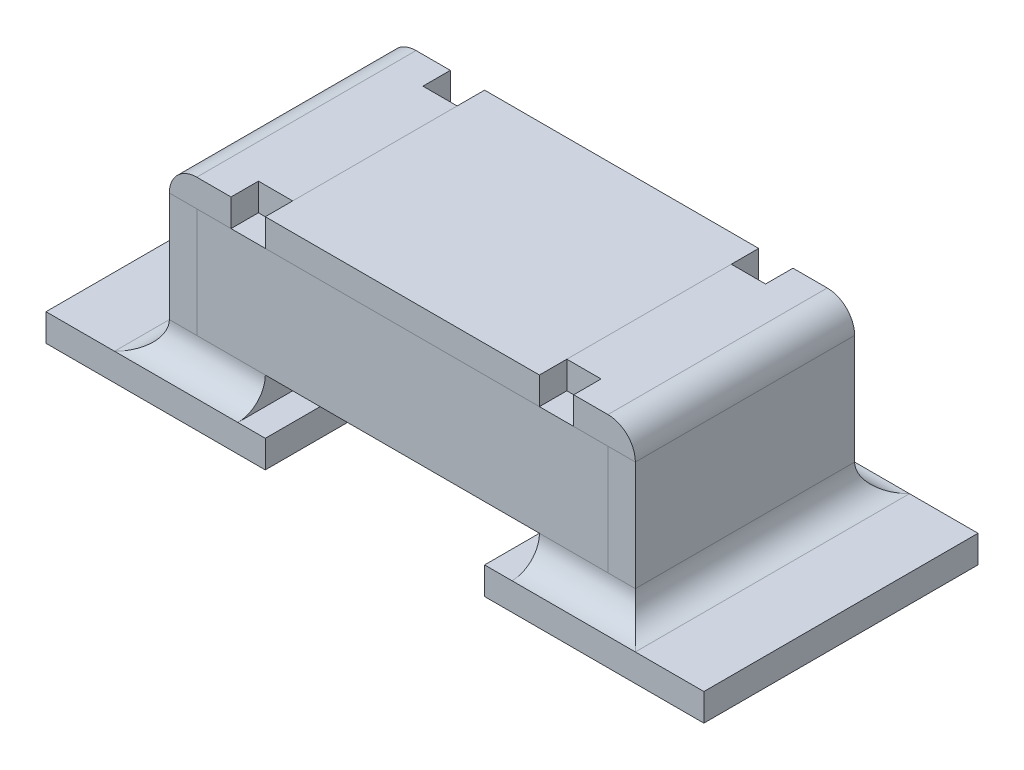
SolidWorks part; units mm, degrees
ref_plane "Plan de face" through (0, 0, 0) normal (0, 0, 1) x (1, 0, 0)
ref_plane "Plan de dessus" through (0, 0, 0) normal (0, 1, 0) x (1, 0, 0)
ref_plane "Plan de droite" through (0, 0, 0) normal (1, 0, 0) x (0, 0, -1)
sketch "Esquisse1" plane through (0, 0, 0) normal (0, 1, 0) x (1, 0, 0)
  line L0 (-0.4, 0) -> (0.4, 0) construction
  line L1 (-0.4, 0.5) -> (-1.2, 0.5)
  line L2 (-0.4, 0.5) -> (-0.4, -0.5)
  line L3 (-0.4, -0.5) -> (-1.2, -0.5)
  line L4 (-1.2, 0.5) -> (-1.2, -0.5)
  line L5 (0.4, 0.5) -> (1.2, 0.5)
  line L6 (0.4, 0.5) -> (0.4, -0.5)
  line L7 (0.4, -0.5) -> (1.2, -0.5)
  line L8 (1.2, 0.5) -> (1.2, -0.5)
  point P8 (-0.4, 0)
  point P12 (0, 0)
  dimension "D1" = 1
  dimension "D2" = 0.8
  dimension "D3" = 0.8
extrude "Boss.-Extru.1" add sketch "Esquisse1" along normal blind 0.1
sketch "Esquisse2" plane through (0, 0.1, 0) normal (0, 1, 0) x (1, 0, 0)
  line L0 (-0.4, 0.5) -> (-1.2, 0.5) construction
  line L1 (-0.85, 0.4) -> (-0.75, 0.4)
  line L2 (-0.85, 0.4) -> (-0.85, -0.4)
  line L3 (-0.85, -0.4) -> (-0.75, -0.4)
  line L4 (-0.75, 0.4) -> (-0.75, -0.4)
  line L5 (0.75, 0.4) -> (0.85, 0.4)
  line L6 (0.75, 0.4) -> (0.75, -0.4)
  line L7 (0.75, -0.4) -> (0.85, -0.4)
  line L8 (0.85, 0.4) -> (0.85, -0.4)
  line L9 (1.2, 0.5) -> (0.4, 0.5) construction
  line L10 (-1.2, -0.5) -> (-0.4, -0.5) construction
  point P8 (-0.8, 0.5)
  point P9 (0.8, 0.5)
  point P12 (-0.8, 0.4)
  point P15 (0.8, 0.4)
  dimension "D1" = 0.1
  dimension "D2" = 0.1
  dimension "D3" = 0.1
extrude "Boss.-Extru.2" add sketch "Esquisse2" along normal blind 0.5
sketch "Esquisse3" plane through (0, 0.1, 0) normal (0, 1, 0) x (1, 0, 0)
  line L0 (-0.85, -0.4) -> (-0.75, -0.4) construction
  line L1 (-0.75, 0.4) -> (-0.5, 0.4)
  line L2 (-0.75, 0.4) -> (-0.75, -0.4)
  line L3 (-0.75, -0.4) -> (-0.5, -0.4)
  line L4 (-0.5, 0.4) -> (-0.5, -0.4)
  line L5 (0.75, 0.4) -> (0.5, 0.4)
  line L6 (0.75, 0.4) -> (0.75, -0.4)
  line L7 (0.75, -0.4) -> (0.5, -0.4)
  line L8 (0.5, 0.4) -> (0.5, -0.4)
  line L9 (-0.4, -0.5) -> (-0.4, 0.5) construction
  line L10 (0.4, 0.5) -> (0.4, -0.5) construction
  dimension "D1" = 0.1
  dimension "D2" = 0.1
extrude "Boss.-Extru.3" add sketch "Esquisse3" along normal blind 0.1
fillet "Congé1" radius 0.1 3 edges at (-0.675, 0.1, -0.4) (-0.675, 0.1, 0.4) (-0.85, 0.1, 0)
fillet "Congé2" radius 0.1 3 edges at (0.675, 0.1, -0.4) (0.85, 0.1, 0) (0.675, 0.1, 0.4)
sketch "Esquisse4" plane through (0, 0.2, 0) normal (0, 1, 0) x (1, 0, 0)
  line L1 (-0.75, 0.4) -> (0.75, 0.4)
  line L2 (-0.75, 0.4) -> (-0.75, -0.4)
  line L3 (-0.75, -0.4) -> (0.75, -0.4)
  line L4 (0.75, 0.4) -> (0.75, -0.4)
extrude "Boss.-Extru.4" add sketch "Esquisse4" along normal blind 0.4 separate body
sketch "Esquisse5" plane through (0, 0.6, 0) normal (0, 1, 0) x (1, 0, 0)
  line L0 (0.75, 0.4) -> (-0.75, 0.4) construction
  line L1 (-0.5, 0.4) -> (0.5, 0.4)
  line L2 (-0.5, 0.4) -> (-0.5, -0.4)
  line L3 (-0.5, -0.4) -> (0.5, -0.4)
  line L4 (0.5, 0.4) -> (0.5, -0.4)
  line L5 (-0.75, -0.4) -> (0.75, -0.4) construction
  point P8 (0, 0.4)
  dimension "D1" = 1
extrude "Boss.-Extru.5" add sketch "Esquisse5" along normal blind 0.1 separate body
sketch "Esquisse6" plane through (0, 0.6, 0) normal (0, 1, 0) x (1, 0, 0)
  line L0 (-0.625, 0.4) -> (-0.85, 0.4)
  line L1 (-0.5, 0.4) -> (-0.75, 0.4) construction
  line L2 (-0.625, 0.4) -> (-0.625, 0.3)
  line L3 (-0.625, 0.3) -> (-0.5, 0.3)
  line L4 (-0.5, 0.4) -> (-0.5, -0.4) construction
  line L5 (-0.5, 0.3) -> (-0.5, -0.3)
  line L6 (-0.5, -0.3) -> (-0.625, -0.3)
  line L7 (-0.625, -0.3) -> (-0.625, -0.4)
  line L8 (-0.75, -0.4) -> (-0.5, -0.4) construction
  line L9 (-0.85, 0.4) -> (-0.85, -0.4)
  line L10 (-0.85, -0.4) -> (-0.625, -0.4)
  line L11 (0.625, -0.4) -> (0.85, -0.4)
  line L12 (0.85, -0.4) -> (0.85, 0.4)
  line L13 (0.75, 0.4) -> (0.5, 0.4) construction
  line L14 (0.625, 0.4) -> (0.625, 0.3)
  line L15 (0.625, 0.3) -> (0.5, 0.3)
  line L16 (0.5, -0.4) -> (0.5, 0.4) construction
  line L17 (0.5, 0.3) -> (0.5, -0.3)
  line L18 (0.85, 0.4) -> (0.625, 0.4)
  line L19 (-0.75, -0.4) -> (0.75, -0.4) construction
  line L21 (0.5, -0.3) -> (0.625, -0.3)
  line L22 (0.625, -0.3) -> (0.625, -0.4)
  dimension "D1" = 0.1
  dimension "D2" = 0.1
extrude "Boss.-Extru.6" add sketch "Esquisse6" along normal blind 0.1 separate body
fillet "Congé3" radius 0.1 1 edges at (-0.85, 0.7, 0)
fillet "Congé4" radius 0.1 1 edges at (0.85, 0.7, 0)
